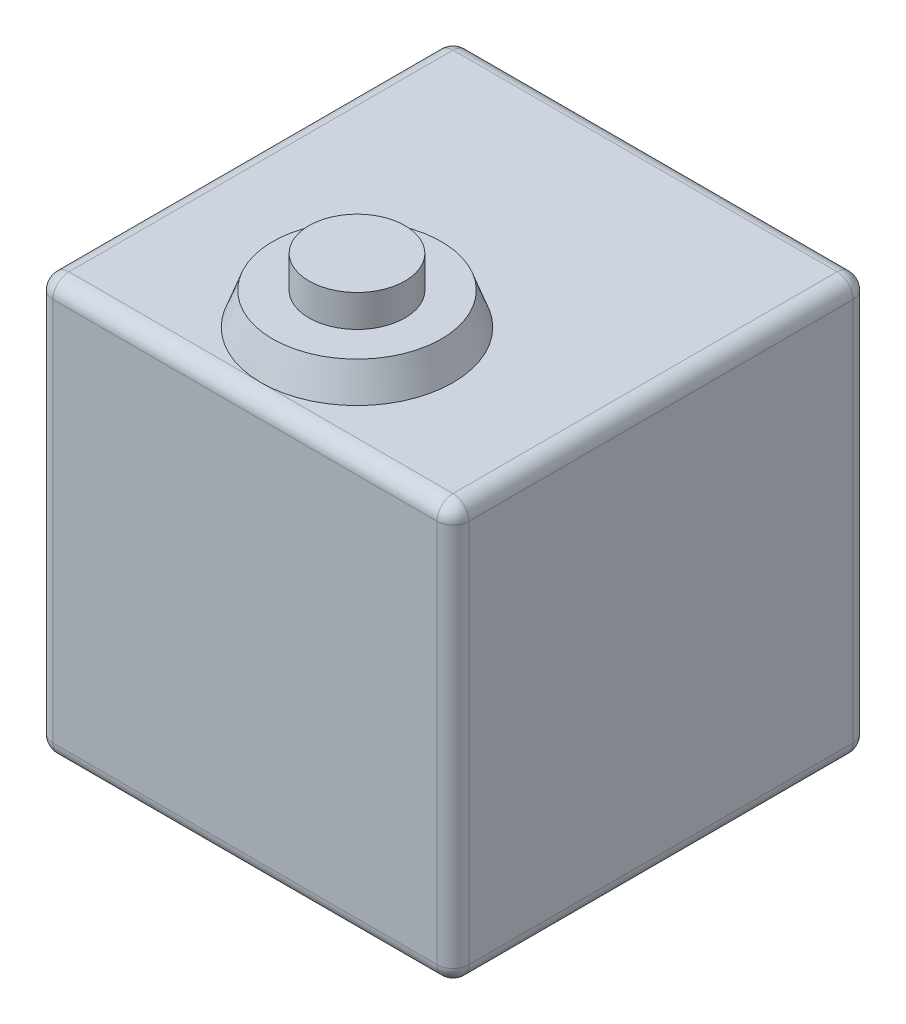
SolidWorks part; units mm, degrees
ref_plane "Front" through (0, 0, 0) normal (0, 0, 1) x (1, 0, 0)
ref_plane "Top" through (0, 0, 0) normal (0, 1, 0) x (1, 0, 0)
ref_plane "Right" through (0, 0, 0) normal (1, 0, 0) x (0, 0, -1)
sketch "Sketch1" plane through (0, 0, 0) normal (0, 1, 0) x (1, 0, 0)
  line L1 (-82.55, -82.55) -> (82.55, -82.55)
  line L2 (-82.55, -82.55) -> (-82.55, 82.55)
  line L3 (-82.55, 82.55) -> (82.55, 82.55)
  line L4 (82.55, -82.55) -> (82.55, 82.55)
  line L5 (-82.55, -82.55) -> (82.55, 82.55) construction
  line L6 (-82.55, 82.55) -> (82.55, -82.55) construction
  point P0 (0, 0)
  dimension "D1" = 165.1
extrude "Boss-Extrude1" add sketch "Sketch1" along normal blind 165.1
fillet "Fillet1" radius 6.35 12 edges at (0, 165.1, -82.55) (0, 0, -82.55) (-82.55, 82.55, -82.55) (-82.55, 165.1, 0) (-82.55, 0, 0) (82.55, 165.1, 0) (82.55, 82.55, -82.55) (82.55, 0, 0) (-82.55, 82.55, 82.55) (0, 165.1, 82.55) (82.55, 82.55, 82.55) (0, 0, 82.55)
sketch "Sketch2" plane through (0, 165.1, 0) normal (0, 1, 0) x (1, 0, 0)
  circle A0 centre (0, -38.1) radius 38.1
  dimension "D1" = 76.2
  dimension "D2" = 38.1
extrude "Boss-Extrude2" add sketch "Sketch2" along normal blind 12.7 draft 20
sketch "Sketch3" plane through (0, 177.8, 0) normal (0, 1, 0) x (1, 0, 0)
  circle A0 centre (0, -38.1) radius 19.05
  dimension "D1" = 38.1
extrude "Boss-Extrude3" add sketch "Sketch3" along normal blind 12.7
